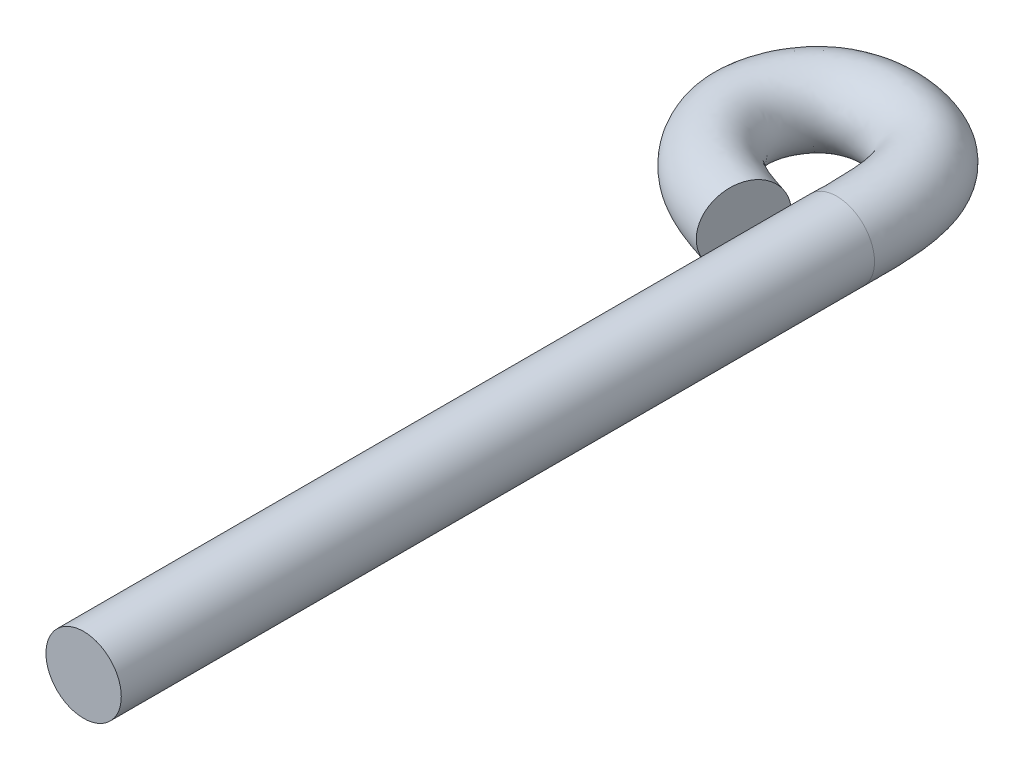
SolidWorks part; units mm, degrees
ref_plane "Face" through (0, 0, 0) normal (0, 0, 1) x (1, 0, 0)
ref_plane "Dessus" through (0, 0, 0) normal (0, 1, 0) x (1, 0, 0)
ref_plane "Droite" through (0, 0, 0) normal (1, 0, 0) x (0, 0, -1)
sketch "Esquisse1" plane through (0, 0, 0) normal (0, 0, 1) x (1, 0, 0)
  circle A0 centre (0, 0) radius 1.1
  dimension "D1" = 2.2
sketch "Esquisse2" plane through (0, 0, 0) normal (0, 1, 0) x (1, 0, 0)
  line L0 (0, 0) -> (0, 22)
  circle A0 centre (-2.1234, 23.6246) radius 2 construction
  spline_without_curve S0
  dimension "D2" = 4
  dimension "D1" = 22
sweep "Balayage3" add profiles "Esquisse1" path "Esquisse2"
